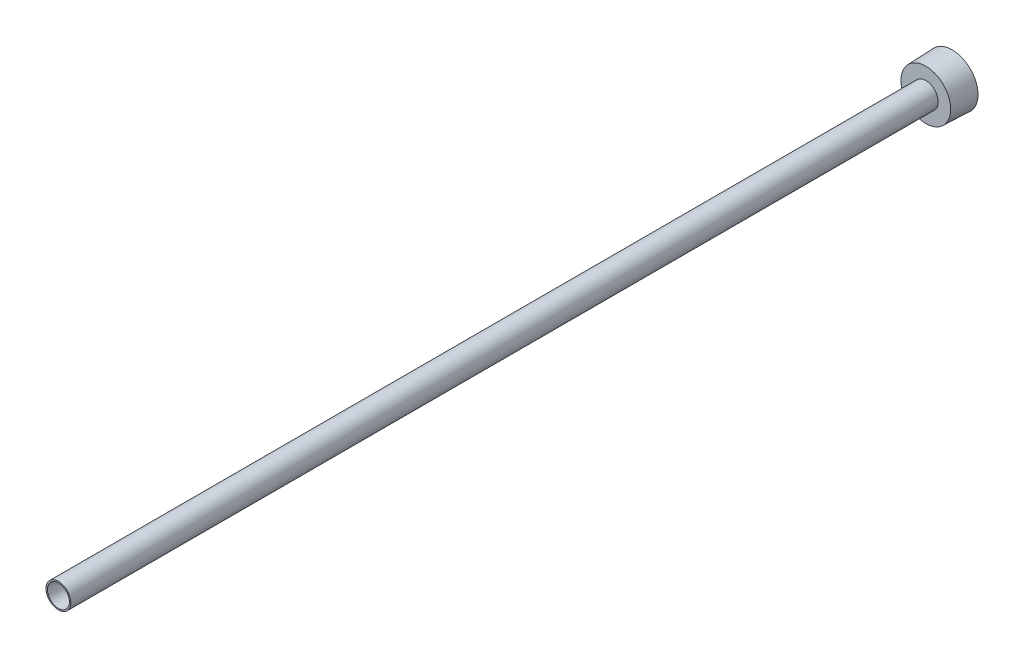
SolidWorks part; units mm, degrees
ref_plane "Front Plane" through (0, 0, 0) normal (0, 0, 1) x (1, 0, 0)
ref_plane "Top Plane" through (0, 0, 0) normal (0, 1, 0) x (1, 0, 0)
ref_plane "Right Plane" through (0, 0, 0) normal (1, 0, 0) x (0, 0, -1)
sketch "Sketch1" plane through (0, 0, 0) normal (1, 0, 0) x (0, 0, -1)
  line L0 (-278.0011, 0) -> (49721.9989, 0) construction
  line L1 (-457.2, 0) -> (0, 0)
  line L6 (0, 0) -> (0, 13.2207)
  line L7 (0, 13.2207) -> (-13.4874, 12.7287)
  line L8 (-13.4874, 12.7287) -> (-13.4874, 6.35)
  line L9 (-13.4874, 6.35) -> (-457.2, 6.35)
  line L10 (-457.2, 6.35) -> (-457.2, 0)
  dimension "D1" = 13.4874
  dimension "D2" = 26.4414
  dimension "D3" = 2.089
  dimension "D4" = 12.7
  dimension "D5" = 457.2
revolve "Revolve1" add sketch "Sketch1" angle 360 about L0
sketch "Sketch2" plane through (0, 0, 457.2) normal (0, 0, 1) x (1, 0, 0)
  circle A0 centre (0, 0) radius 5.6388
  dimension "D1" = 11.2776
extrude "Cut-Extrude1" cut sketch "Sketch2" against normal through all
sketch "Sketch3" plane through (0, 0, 0) normal (0, 0, -1) x (-1, 0, 0)
  line L0 (0, 14.5428) -> (0, -14.5428) construction
  line L1 (-9.525, -5.4993) -> (0, -10.9985)
  line L2 (0, -10.9985) -> (9.525, -5.4993)
  line L3 (9.525, -5.4993) -> (9.525, 5.4993)
  line L4 (9.525, 5.4993) -> (0, 10.9985)
  line L5 (0, 10.9985) -> (-9.525, 5.4993)
  line L6 (-9.525, 5.4993) -> (-9.525, -5.4993)
  circle A0 centre (0, 0) radius 9.525 construction
  dimension "D1" = 19.05
extrude "Cut-Extrude2" cut sketch "Sketch3" against normal blind 9.525
